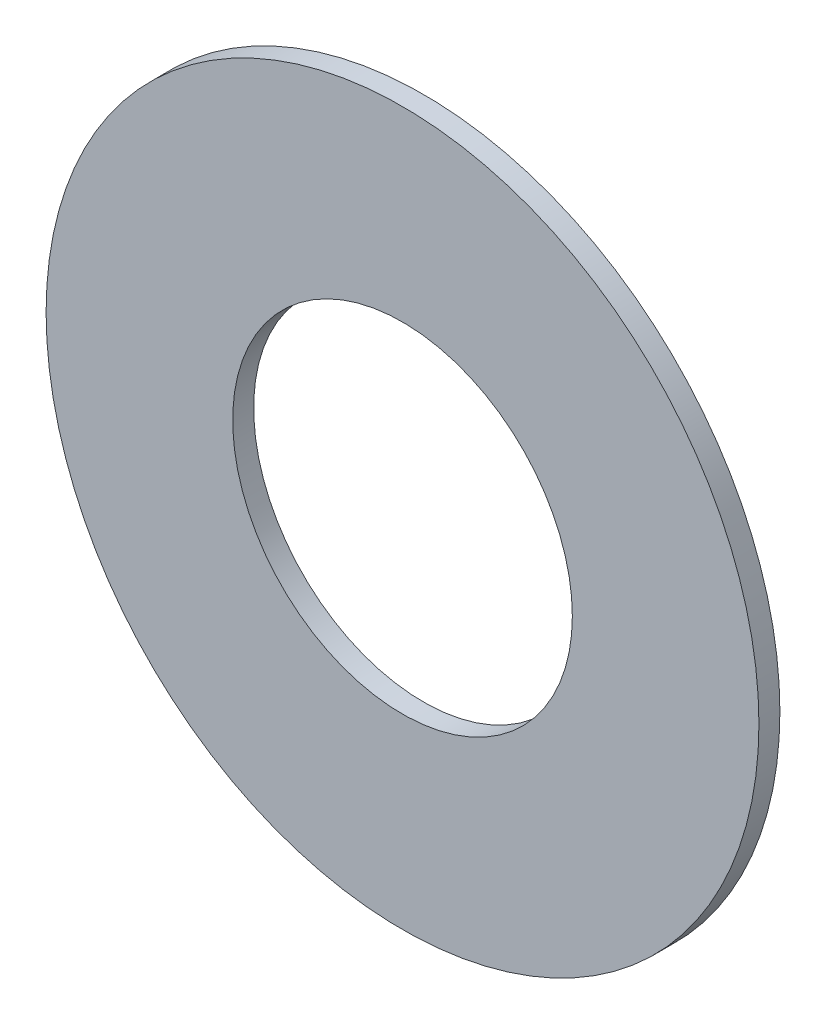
SolidWorks part; units mm, degrees
ref_plane "Plane1" through (0, 0, 0) normal (0, 0, 1) x (1, 0, 0)
ref_plane "Plane2" through (0, 0, 0) normal (0, 1, 0) x (1, 0, 0)
ref_plane "Plane3" through (0, 0, 0) normal (1, 0, 0) x (0, 0, -1)
sketch "Esquisse1" plane through (0, 0, 0) normal (0, 0, 1) x (1, 0, 0)
  circle A0 centre (0, 0) radius 17
  circle A1 centre (0, 0) radius 8.1
  dimension "D1" = 16.2
  dimension "D2" = 34
extrude "Base-Extrusion" add sketch "Esquisse1" along normal blind 1
